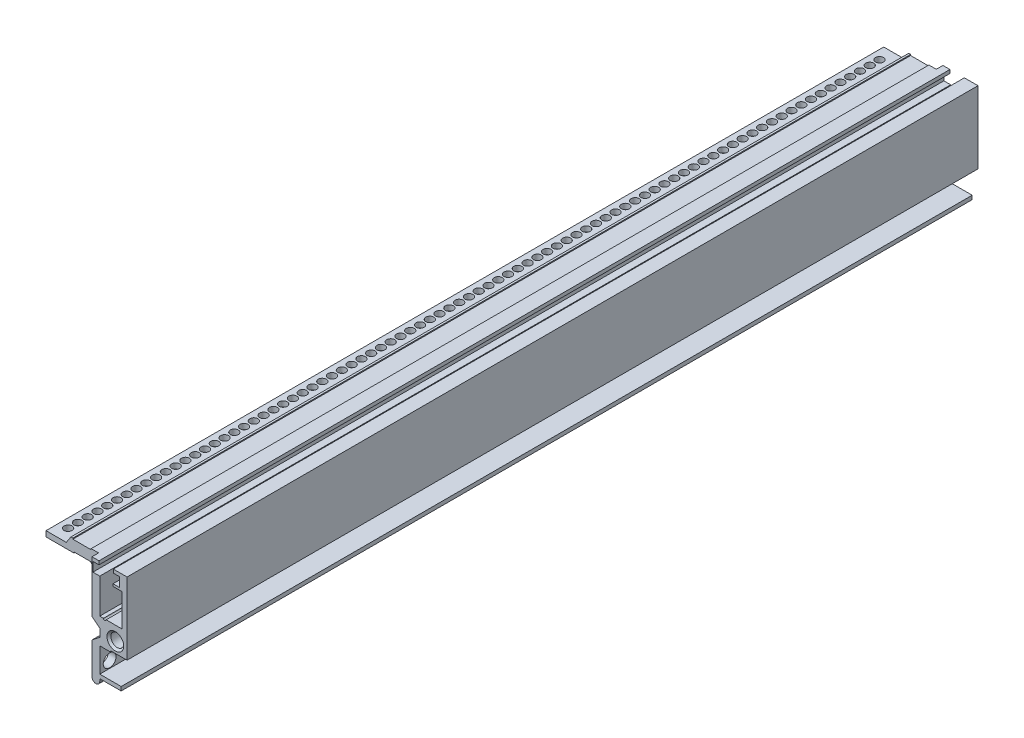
SolidWorks part; units mm, degrees
ref_plane "前视基准面" through (0, 0, 0) normal (0, 0, 1) x (1, 0, 0)
ref_plane "上视基准面" through (0, 0, 0) normal (0, 1, 0) x (1, 0, 0)
ref_plane "右视基准面" through (0, 0, 0) normal (1, 0, 0) x (0, 0, -1)
sketch "Model" plane through (0, 0, 0) normal (0, 0, 1) x (1, 0, 0)
  line L0 (2281.8705, 1522.2598) -> (2281.8705, 1503.7598)
  line L1 (2277.6705, 1503.7598) -> (2277.6705, 1503.4598)
  line L2 (2280.6205, 1518.3598) -> (2280.6205, 1510.0598)
  line L3 (2278.3705, 1522.2598) -> (2278.3705, 1521.3598)
  line L4 (2274.6705, 1522.2598) -> (2274.6705, 1521.3598)
  line L5 (2270.9705, 1522.2598) -> (2270.9705, 1522.0098)
  line L6 (2281.8705, 1522.2598) -> (2278.3705, 1522.2598)
  line L7 (2281.8705, 1503.7598) -> (2277.6705, 1503.7598)
  line L8 (2280.3705, 1496.1598) -> (2274.8705, 1496.1598)
  line L9 (2280.3705, 1497.1598) -> (2274.8705, 1497.1598)
  line L10 (2280.6205, 1518.3598) -> (2278.2705, 1518.3598)
  line L11 (2280.6205, 1510.0598) -> (2276.5105, 1510.0598)
  line L12 (2275.8305, 1510.0598) -> (2274.8705, 1510.0598)
  line L13 (2279.9205, 1518.9598) -> (2278.2705, 1518.9598)
  line L14 (2279.9205, 1521.3598) -> (2278.3705, 1521.3598)
  line L15 (2274.6705, 1522.2598) -> (2270.9705, 1522.2598)
  line L16 (2266.5705, 1519.0598) -> (2259.3705, 1519.0598)
  line L17 (2270.9705, 1519.3098) -> (2266.5705, 1519.3098)
  line L18 (2264.5705, 1520.4598) -> (2259.3705, 1520.4598)
  line L19 (2270.9705, 1522.0098) -> (2266.2705, 1522.0098)
  line L20 (2259.3705, 1520.4598) -> (2259.3705, 1519.0598)
  line L21 (2266.5705, 1519.3098) -> (2266.5705, 1519.0598)
  line L22 (2266.2705, 1522.2598) -> (2266.2705, 1522.0098)
  line L23 (2266.2705, 1522.2598) -> (2265.7705, 1522.2598)
  line L24 (2272.8705, 1516.5598) -> (2272.8705, 1508.9598)
  line L25 (2272.8705, 1503.7598) -> (2272.8705, 1495.5598)
  line L26 (2280.3705, 1497.1598) -> (2280.3705, 1496.1598)
  line L27 (2274.8705, 1496.1598) -> (2274.8705, 1495.5598)
  line L28 (2274.8705, 1507.3598) -> (2274.8705, 1505.3598)
  line L29 (2274.6705, 1521.3598) -> (2273.1205, 1521.3598)
  line L30 (2279.9205, 1521.3598) -> (2279.9205, 1518.9598)
  line L31 (2273.1205, 1521.3598) -> (2273.1205, 1518.9598)
  line L32 (2274.8705, 1518.9598) -> (2273.1205, 1518.9598)
  line L33 (2270.9705, 1519.3098) -> (2270.9705, 1519.0598)
  line L34 (2278.2705, 1518.9598) -> (2278.2705, 1518.3598)
  line L35 (2272.8705, 1508.9598) -> (2274.8705, 1507.3598)
  line L36 (2274.8705, 1505.3598) -> (2272.8705, 1503.7598)
  line L37 (2274.8705, 1518.9598) -> (2274.8705, 1510.0598)
  line L38 (2277.6705, 1503.4598) -> (2274.8705, 1503.4598)
  line L39 (2274.8705, 1497.1598) -> (2274.8705, 1503.4598)
  line L43 (2264.5705, 1520.4598) -> (2265.7705, 1522.2598)
  line L44 (2270.9705, 1519.0598) -> (2272.8705, 1516.5598)
  arc A0 (2275.8305, 1510.0598) -> (2276.5105, 1510.0598) centre (2276.1705, 1510.0598) ccw
  arc A1 (2272.8705, 1495.5598) -> (2274.8705, 1495.5598) centre (2273.8705, 1495.5598) ccw
extrude "凸台-拉伸1" add sketch "Model" along normal blind 218.44
hole_wizard "M4 螺纹孔1" positions "草图3" profile "草图2" tap size "M4" standard "Gb"
sketch "草图3" plane through (0, 0, 218.44) normal (0, 0, 1) x (1, 0, 0)
  line L0 (2281.8705, 1503.7598) -> (2281.8705, 1522.2598) construction
  line L1 (2281.8705, 1522.2598) -> (2278.3705, 1522.2598) construction
  point P0 (2278.8705, 1506.4598)
  dimension "D1" = 3
  dimension "D2" = 15.8
sketch "草图2" plane through (2278.8705, 1506.4598, 218.44) normal (1, 0, 0) x (0, -1, 0)
  line L0 (0, 0) -> (0, 24.4914)
  line L1 (0, 24.4914) -> (1.65, 23.5)
  line L2 (1.65, 23.5) -> (1.65, 0)
  line L5 (1.65, 0) -> (0, 0)
  line L10 (0, 24.4914) -> (-1.65, 23.5) construction
  line L11 (0, -6.35) -> (0, 107.95) construction
  dimension "螺纹孔钻头直径" = 3.3
  dimension "螺纹孔钻头深度" = 23.5
  dimension "导头角度" = 118
hole_wizard "M4 螺纹孔2" positions "草图5" profile "草图4" tap size "M4" standard "Gb"
sketch "草图5" plane through (0, 0, 0) normal (0, 0, -1) x (-1, 0, 0)
  line L0 (-2281.8705, 1503.7598) -> (-2281.8705, 1522.2598) construction
  line L1 (-2281.8705, 1522.2598) -> (-2278.3705, 1522.2598) construction
  point P0 (-2278.8705, 1506.4598)
  dimension "D1" = 3
  dimension "D2" = 15.8
sketch "草图4" plane through (2278.8705, 1506.4598, 0) normal (1, 0, 0) x (0, 1, 0)
  line L0 (0, 0) -> (0, 24.4914)
  line L1 (0, 24.4914) -> (1.65, 23.5)
  line L2 (1.65, 23.5) -> (1.65, 0)
  line L5 (1.65, 0) -> (0, 0)
  line L10 (0, 24.4914) -> (-1.65, 23.5) construction
  line L11 (0, -6.35) -> (0, 107.95) construction
  dimension "螺纹孔钻头直径" = 3.3
  dimension "螺纹孔钻头深度" = 23.5
  dimension "导头角度" = 118
chamfer "倒角1" distance 0.5 angle 45 2 edges at (2277.2205, 1506.4598, 0) (2280.5205, 1506.4598, 218.44)
sketch "草图6" plane through (2272.8705, 0, 0) normal (-1, 0, 0) x (0, 0, 1)
  line L0 (218.44, 1503.7598) -> (218.44, 1495.5598) construction
  line L1 (218.44, 1522.2598) -> (0, 1522.2598) construction
  circle A0 centre (215.9, 1498.9598) radius 1.65
  circle A1 centre (210.82, 1498.9598) radius 1.65
  circle A2 centre (205.74, 1498.9598) radius 1.65
  circle A3 centre (200.66, 1498.9598) radius 1.65
  circle A4 centre (195.58, 1498.9598) radius 1.65
  circle A5 centre (190.5, 1498.9598) radius 1.65
  circle A6 centre (185.42, 1498.9598) radius 1.65
  circle A7 centre (180.34, 1498.9598) radius 1.65
  circle A8 centre (175.26, 1498.9598) radius 1.65
  circle A9 centre (170.18, 1498.9598) radius 1.65
  circle A10 centre (165.1, 1498.9598) radius 1.65
  circle A11 centre (160.02, 1498.9598) radius 1.65
  circle A12 centre (154.94, 1498.9598) radius 1.65
  circle A13 centre (149.86, 1498.9598) radius 1.65
  circle A14 centre (144.78, 1498.9598) radius 1.65
  circle A15 centre (139.7, 1498.9598) radius 1.65
  circle A16 centre (134.62, 1498.9598) radius 1.65
  circle A17 centre (129.54, 1498.9598) radius 1.65
  circle A18 centre (124.46, 1498.9598) radius 1.65
  circle A19 centre (119.38, 1498.9598) radius 1.65
  circle A20 centre (114.3, 1498.9598) radius 1.65
  circle A21 centre (109.22, 1498.9598) radius 1.65
  circle A22 centre (104.14, 1498.9598) radius 1.65
  circle A23 centre (99.06, 1498.9598) radius 1.65
  circle A24 centre (93.98, 1498.9598) radius 1.65
  circle A25 centre (88.9, 1498.9598) radius 1.65
  circle A26 centre (83.82, 1498.9598) radius 1.65
  circle A27 centre (78.74, 1498.9598) radius 1.65
  circle A28 centre (73.66, 1498.9598) radius 1.65
  circle A29 centre (68.58, 1498.9598) radius 1.65
  circle A30 centre (63.5, 1498.9598) radius 1.65
  circle A31 centre (58.42, 1498.9598) radius 1.65
  circle A32 centre (53.34, 1498.9598) radius 1.65
  circle A33 centre (48.26, 1498.9598) radius 1.65
  circle A34 centre (43.18, 1498.9598) radius 1.65
  circle A35 centre (38.1, 1498.9598) radius 1.65
  circle A36 centre (33.02, 1498.9598) radius 1.65
  circle A37 centre (27.94, 1498.9598) radius 1.65
  circle A38 centre (22.86, 1498.9598) radius 1.65
  circle A39 centre (17.78, 1498.9598) radius 1.65
  circle A40 centre (12.7, 1498.9598) radius 1.65
  circle A41 centre (7.62, 1498.9598) radius 1.65
  circle A42 centre (2.54, 1498.9598) radius 1.65
extrude "切除-拉伸1" cut sketch "草图6" against normal blind 10
hole_wizard "M2.5 螺纹孔1"
sketch "草图8" plane through (0, 1520.4598, 0) normal (0, 1, 0) x (1, 0, 0)
  line L0 (2264.5705, -218.44) -> (2259.3705, -218.44) construction
  line L1 (2259.3705, -218.44) -> (2259.3705, 0) construction
  line L2 (2264.5705, 0) -> (2259.3705, 0) construction
  point P0 (2261.6705, -213.36)
  point P13 (2261.6705, -210.8506)
  point P14 (2261.6705, -208.3412)
  point P15 (2261.6705, -205.8318)
  point P16 (2261.6705, -203.3224)
  point P17 (2261.6705, -200.813)
  point P18 (2261.6705, -198.3036)
  point P19 (2261.6705, -195.7942)
  point P20 (2261.6705, -193.2848)
  point P21 (2261.6705, -190.7754)
  point P22 (2261.6705, -188.266)
  point P23 (2261.6705, -185.7566)
  point P24 (2261.6705, -183.2472)
  point P25 (2261.6705, -180.7378)
  point P26 (2261.6705, -178.2284)
  point P27 (2261.6705, -175.719)
  point P28 (2261.6705, -173.2096)
  point P29 (2261.6705, -170.7002)
  point P30 (2261.6705, -168.1908)
  point P31 (2261.6705, -165.6814)
  point P32 (2261.6705, -163.172)
  point P33 (2261.6705, -160.6627)
  point P34 (2261.6705, -158.1533)
  point P35 (2261.6705, -155.6439)
  point P36 (2261.6705, -153.1345)
  point P37 (2261.6705, -150.6251)
  point P38 (2261.6705, -148.1157)
  point P39 (2261.6705, -145.6063)
  point P40 (2261.6705, -143.0969)
  point P41 (2261.6705, -140.5875)
  point P42 (2261.6705, -138.0781)
  point P43 (2261.6705, -135.5687)
  point P44 (2261.6705, -133.0593)
  point P45 (2261.6705, -130.5499)
  point P46 (2261.6705, -128.0405)
  point P47 (2261.6705, -125.5311)
  point P48 (2261.6705, -123.0217)
  point P49 (2261.6705, -120.5123)
  point P50 (2261.6705, -118.0029)
  point P51 (2261.6705, -115.4935)
  point P52 (2261.6705, -112.9841)
  point P53 (2261.6705, -110.4747)
  point P54 (2261.6705, -107.9653)
  point P55 (2261.6705, -105.4559)
  point P56 (2261.6705, -102.9465)
  point P57 (2261.6705, -100.4371)
  point P58 (2261.6705, -97.9277)
  point P59 (2261.6705, -95.4183)
  point P60 (2261.6705, -92.9089)
  point P61 (2261.6705, -90.3995)
  point P62 (2261.6705, -87.8901)
  point P63 (2261.6705, -85.3807)
  point P64 (2261.6705, -82.8713)
  point P65 (2261.6705, -80.3619)
  point P66 (2261.6705, -77.8525)
  point P67 (2261.6705, -75.3431)
  point P68 (2261.6705, -72.8337)
  point P69 (2261.6705, -70.3243)
  point P70 (2261.6705, -67.8149)
  point P71 (2261.6705, -65.3055)
  point P72 (2261.6705, -62.7961)
  point P73 (2261.6705, -60.2867)
  point P74 (2261.6705, -57.7773)
  point P75 (2261.6705, -55.268)
  point P76 (2261.6705, -52.7586)
  point P77 (2261.6705, -50.2492)
  point P78 (2261.6705, -47.7398)
  point P79 (2261.6705, -45.2304)
  point P80 (2261.6705, -42.721)
  point P81 (2261.6705, -40.2116)
  point P82 (2261.6705, -37.7022)
  point P83 (2261.6705, -35.1928)
  point P84 (2261.6705, -32.6834)
  point P85 (2261.6705, -30.174)
  point P86 (2261.6705, -27.6646)
  point P87 (2261.6705, -25.1552)
  point P88 (2261.6705, -22.6458)
  point P89 (2261.6705, -20.1364)
  point P90 (2261.6705, -17.627)
  point P91 (2261.6705, -15.1176)
  point P92 (2261.6705, -12.6082)
  point P93 (2261.6705, -10.0988)
  point P94 (2261.6705, -7.5894)
  point P95 (2261.6705, -5.08)
  dimension "D1" = 5.08
  dimension "D2" = 2.3
  dimension "D4" = 5.08
  dimension "D3" = 84
sketch "草图7" plane through (2261.6705, 1520.4598, 213.36) normal (1, 0, 0) x (0, 0, 1)
  line L0 (0, 0) -> (0, 7.8659)
  line L1 (0, 7.8659) -> (1.025, 7.25)
  line L2 (1.025, 7.25) -> (1.025, 0)
  line L5 (1.025, 0) -> (0, 0)
  line L10 (0, 7.8659) -> (-1.025, 7.25) construction
  line L11 (0, -6.35) -> (0, 107.95) construction
  dimension "螺纹孔钻头直径" = 2.05
  dimension "螺纹孔钻头深度" = 7.25
  dimension "导头角度" = 118
sketch "草图9" plane through (0, 1519.0598, 0) normal (0, -1, 0) x (1, 0, 0)
  line L0 (2272.8705, 218.44) -> (2272.8705, 0) construction
  line L2 (2259.3705, 218.44) -> (2272.8705, 218.44)
  line L3 (2259.3705, 218.44) -> (2259.3705, 216.74)
  line L4 (2259.3705, 216.74) -> (2272.8705, 216.74)
  line L5 (2272.8705, 218.44) -> (2272.8705, 216.74)
  line L6 (2259.3705, 0) -> (2272.8705, 0)
  line L7 (2259.3705, 0) -> (2259.3705, 1.7)
  line L8 (2259.3705, 1.7) -> (2272.8705, 1.7)
  line L9 (2272.8705, 0) -> (2272.8705, 1.7)
  dimension "D1" = 1.7
  dimension "D2" = 1.7
extrude "切除-拉伸2" cut sketch "草图9" against normal through all and the other way through all
equation "\"D4@草图6\"=\"D1@凸台-拉伸1\"/5.08"
